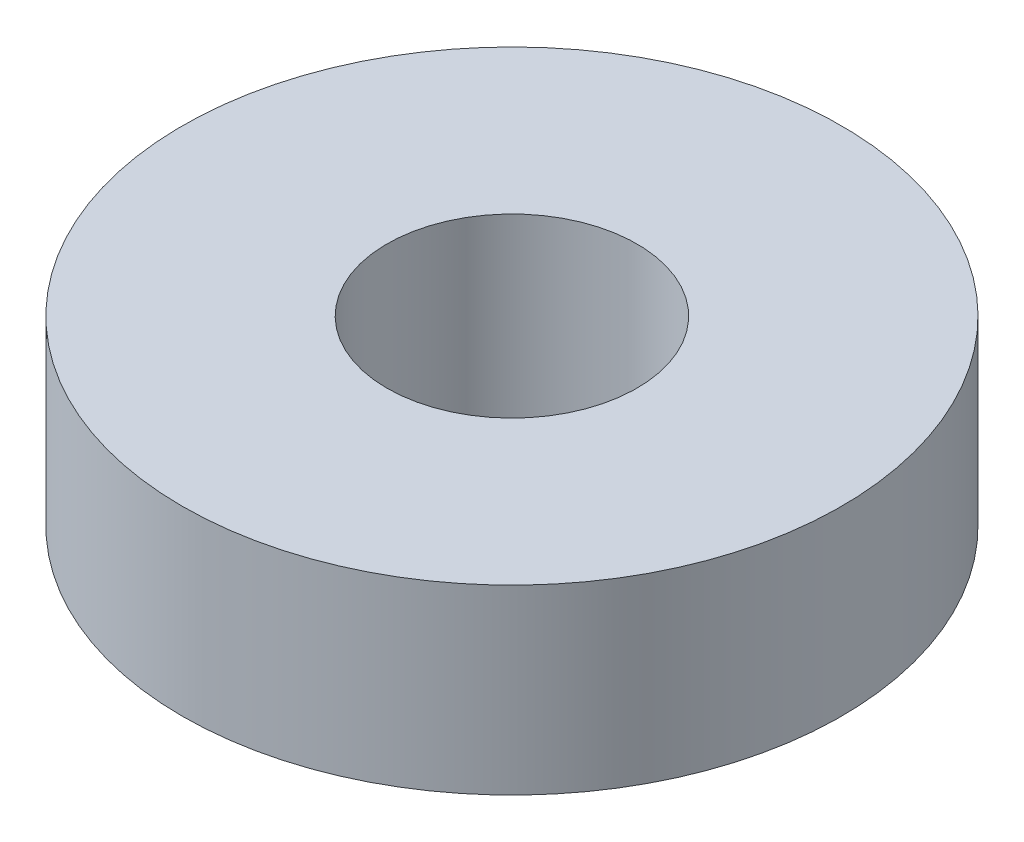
SolidWorks part; units mm, degrees
ref_plane "Front Plane" through (0, 0, 0) normal (0, 0, 1) x (1, 0, 0)
ref_plane "Top Plane" through (0, 0, 0) normal (0, 1, 0) x (1, 0, 0)
ref_plane "Right Plane" through (0, 0, 0) normal (1, 0, 0) x (0, 0, -1)
sketch "Sketch1" plane through (0, 0, 0) normal (0, 1, 0) x (1, 0, 0)
  circle A0 centre (0, 0) radius 3.4925
  circle A1 centre (0, 0) radius 9.2075
  dimension "D1" = 6.985
  dimension "D2" = 18.415
extrude "Boss-Extrude1" add sketch "Sketch1" along normal blind 5.08
